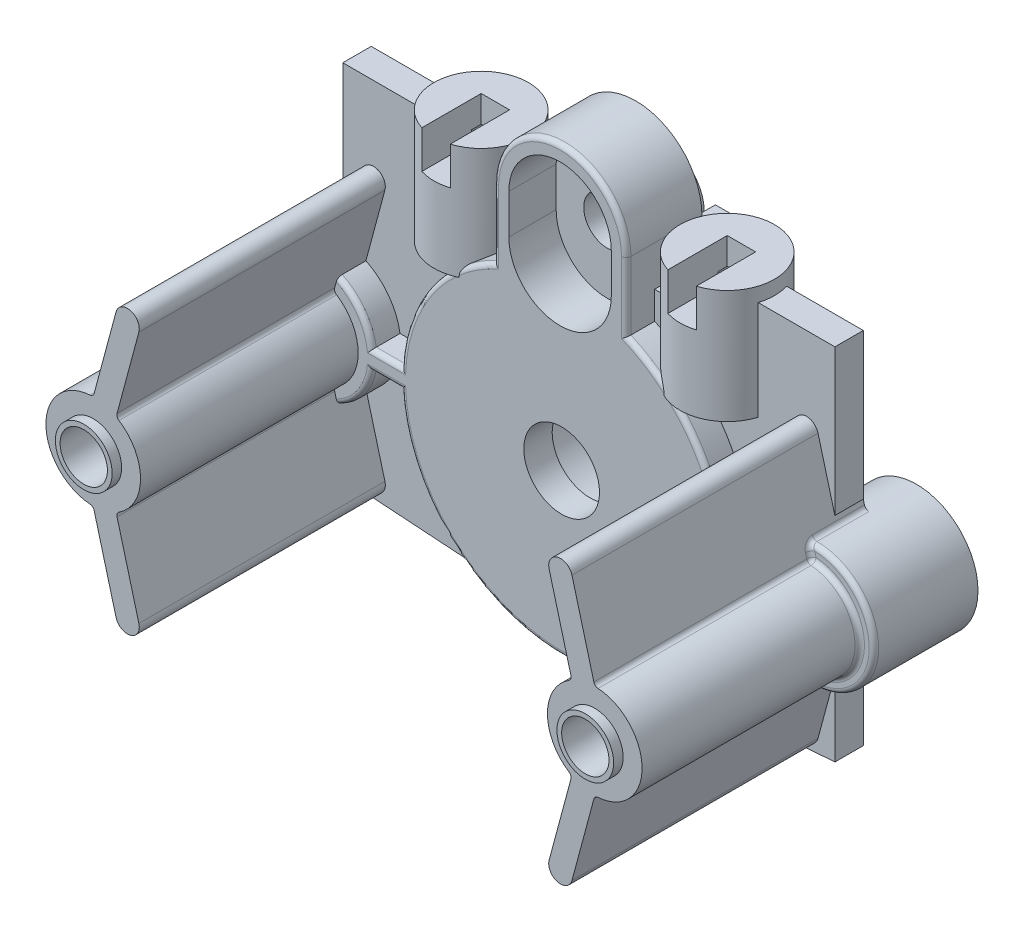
SolidWorks part; units mm, degrees
ref_plane "Plane1" through (0, 0, 0) normal (0, 0, 1) x (1, 0, 0)
ref_plane "Plane2" through (0, 0, 0) normal (0, 1, 0) x (1, 0, 0)
ref_plane "Plane3" through (0, 0, 0) normal (1, 0, 0) x (0, 0, -1)
sketch "Esquisse6" plane through (0, 0, 0) normal (0, 0, 1) x (1, 0, 0)
  line L0 (0, 0) -> (52, 0)
  line L1 (0, 0) -> (0, 38)
  line L2 (52, 38) -> (0, 38)
  line L3 (52, 38) -> (52, 0)
  dimension "D1" = 38
  dimension "D2" = 52
extrude "Base-Extrusion" add sketch "Esquisse6" along normal blind 3
sketch "Esquisse7" plane through (63.6237, 67.2393, 3) normal (0, 0, 1) x (1, 0, 0)
  line L2 (-11, -52) -> (-34, -52) construction
  line L3 (-11, -57) -> (-13.4089, -65.973)
  line L4 (-13.4207, -56.3749) -> (-15.8234, -65.3248)
  line L5 (-11, -47) -> (-13.4089, -38.027)
  line L6 (-13.4207, -47.6251) -> (-15.8234, -38.6752)
  line L7 (-37.5, -73) -> (-37.5, -13) construction
  line L9 (-64, -47) -> (-61.5911, -38.027)
  line L10 (-61.5793, -47.6251) -> (-59.1766, -38.6752)
  line L11 (-61.5793, -56.3749) -> (-59.1766, -65.3248)
  line L12 (-64, -57) -> (-61.5911, -65.973)
  arc A0 (-13.4207, -47.6251) -> (-13.4207, -56.3749) centre (-11, -52) ccw
  arc A1 (-13.4089, -38.027) -> (-15.8234, -38.6752) centre (-14.6162, -38.3511) ccw
  arc A2 (-13.4089, -65.973) -> (-15.8234, -65.3248) centre (-14.6162, -65.6489) cw
  arc A3 (-11, -57) -> (-11, -47) centre (-11, -52) ccw
  arc A4 (-64, -57) -> (-64, -47) centre (-64, -52) cw
  arc A5 (-61.5793, -47.6251) -> (-61.5793, -56.3749) centre (-64, -52) cw
  arc A6 (-61.5911, -38.027) -> (-59.1766, -38.6752) centre (-60.3838, -38.3511) cw
  arc A7 (-61.5911, -65.973) -> (-59.1766, -65.3248) centre (-60.3838, -65.6489) ccw
  dimension "D1" = 10
  dimension "D6" = 2.5
  dimension "D4" = 2.5
  dimension "D5" = 1.25
extrude "Boss.-Extru.3" add sketch "Esquisse7" along normal blind 29
sketch "Esquisse8" plane through (0, 0, 3) normal (0, 0, 1) x (1, 0, 0)
  line L0 (0, 38) -> (52, 38)
  line L1 (0, 38) -> (0, 0)
  line L2 (52, 0) -> (0, 0)
  line L3 (52, 0) -> (52, 38)
extrude "Boss.-Extru.4" add sketch "Esquisse8" along normal blind 3
sketch "Esquisse9" plane through (0, 0, 0) normal (0, 0, -1) x (-1, 0, 0)
  line L0 (-52, 38) -> (0, 38)
  line L1 (-52, 38) -> (-52, 0)
  line L2 (0, 0) -> (-52, 0)
  line L3 (0, 0) -> (0, 38)
extrude "Enlèv. mat.-Extru.5" cut sketch "Esquisse9" against normal blind 3
sketch "Esquisse10" plane through (0, 0, 32) normal (0, 0, 1) x (1, 0, 0)
  circle A0 centre (-0.3763, 15.2393) radius 2.5
  circle A1 centre (52.6237, 15.2393) radius 2.5
  dimension "D1" = 5
  dimension "D2" = 5
extrude "Enlèv. mat.-Extru.6" cut sketch "Esquisse10" against normal blind 43
sketch "Esquisse11" plane through (0, 0, 32) normal (0, 0, 1) x (1, 0, 0)
  circle A0 centre (-0.3763, 15.2393) radius 3
  circle A1 centre (52.6237, 15.2393) radius 3
  circle A2 centre (-0.3763, 15.2393) radius 2.5
  circle A3 centre (52.6237, 15.2393) radius 2.5
  dimension "D1" = 6
  dimension "D2" = 6
  dimension "D3" = 5
  dimension "D4" = 5
extrude "Boss.-Extru.5" add sketch "Esquisse11" along normal blind 1
sketch "Esquisse12" plane through (0, 0, 3) normal (0, 0, -1) x (-1, 0, 0)
  circle A0 centre (-52.6237, 15.2393) radius 6.5
  circle A1 centre (0.3763, 15.2393) radius 6.5
  dimension "D1" = 13
  dimension "D2" = 13
extrude "Boss.-Extru.6" add sketch "Esquisse12" against normal blind 6
sketch "Esquisse13" plane through (0, 0, 3) normal (0, 0, -1) x (-1, 0, 0)
  circle A0 centre (-52.6237, 15.2393) radius 6.5
  circle A1 centre (0.3763, 15.2393) radius 6.5
  dimension "D1" = 13
  dimension "D2" = 13
extrude "Boss.-Extru.7" add sketch "Esquisse13" along normal blind 5
sketch "Esquisse14" plane through (0, 0, -2) normal (0, 0, -1) x (-1, 0, 0)
  circle A0 centre (-52.6237, 15.2393) radius 4.5
  circle A1 centre (0.3763, 15.2393) radius 4.5
  dimension "D1" = 9
  dimension "D2" = 9
extrude "Enlèv. mat.-Extru.7" cut sketch "Esquisse14" against normal blind 6
sketch "Esquisse15" plane through (0, 0, 4) normal (0, 0, -1) x (-1, 0, 0)
  circle A0 centre (-52.6237, 15.2393) radius 2.5
  circle A1 centre (0.3763, 15.2393) radius 2.5
  dimension "D1" = 5
  dimension "D2" = 5
extrude "Enlèv. mat.-Extru.8" cut sketch "Esquisse15" against normal blind 16
sketch "Esquisse16" plane through (0, 0, 3) normal (0, 0, -1) x (-1, 0, 0)
  line L0 (-52.6237, 15.2393) -> (0.3763, 15.2393) construction
  line L1 (-26.1237, 15.2393) -> (-26.1237, 41.9193) construction
  circle A0 centre (-26.1237, 15.2393) radius 17
  dimension "D1" = 34
extrude "Boss.-Extru.8" add sketch "Esquisse16" along normal blind 5
sketch "Esquisse17" plane through (0, 0, 6) normal (0, 0, 1) x (1, 0, 0)
  line L0 (0, 0) -> (26.1237, -1.7607)
  line L1 (26.1237, -1.7607) -> (52, 0)
  line L2 (52, 0) -> (0, 0)
  arc A0 (18.5895, 0) -> (33.6579, 0) centre (26.1237, 15.2393) ccw construction
extrude "Boss.-Extru.10" add sketch "Esquisse17" against normal blind 3
sketch "Esquisse20" plane through (0, 0, -2) normal (0, 0, -1) x (-1, 0, 0)
  line L0 (-52.6237, 15.2393) -> (-38.9139, 15.2393) construction
  line L1 (-42.2354, 16.2429) -> (-48.2354, 16.2429)
  line L2 (-42.2354, 16.2429) -> (-42.2354, 14.2429)
  line L3 (-48.2354, 14.2429) -> (-42.2354, 14.2429)
  line L4 (-48.2354, 14.2429) -> (-48.2354, 16.2429)
  line L5 (-26.1237, 15.2393) -> (-26.1237, 27.3291) construction
  line L6 (-10.012, 16.2429) -> (-4.012, 16.2429)
  line L7 (-4.012, 14.2429) -> (-10.012, 14.2429)
  line L8 (-4.012, 14.2429) -> (-4.012, 16.2429)
  line L9 (-10.012, 16.2429) -> (-10.012, 14.2429)
  circle A0 centre (-52.6237, 15.2393) radius 4.5 construction
  dimension "D1" = 2
  dimension "D2" = 6
extrude "Boss.-Extru.12" add sketch "Esquisse20" against normal blind 5
sketch "Esquisse21" plane through (0, 0, 6) normal (0, 0, 1) x (1, 0, 0)
  circle A0 centre (26.1237, 15.2393) radius 17
extrude "Boss.-Extru.13" add sketch "Esquisse21" along normal blind 3
sketch "Esquisse22" plane through (0, 0, 9) normal (0, 0, 1) x (1, 0, 0)
  line L0 (10.1518, 16.2429) -> (3.2399, 16.2429)
  line L1 (10.1518, 16.2429) -> (10.1518, 14.2429)
  line L2 (3.2399, 14.2429) -> (10.1518, 14.2429)
  line L3 (3.2399, 14.2429) -> (3.2399, 16.2429)
  line L4 (26.1237, 15.2393) -> (26.1237, 28.5641) construction
  line L5 (42.0956, 16.2429) -> (49.0075, 16.2429)
  line L6 (49.0075, 14.2429) -> (42.0956, 14.2429)
  line L7 (49.0075, 14.2429) -> (49.0075, 16.2429)
  line L8 (42.0956, 16.2429) -> (42.0956, 14.2429)
  dimension "D1" = 2
extrude "Boss.-Extru.14" add sketch "Esquisse22" against normal blind 4
ref_plane "Plan4" through (0, 39.5, 0) normal (0, 1, 0) x (-1, 0, 0)
sketch "Esquisse23" plane through (0, 39.5, 0) normal (0, 1, 0) x (-1, 0, 0)
  line L0 (-52, 3) -> (0, 3) construction
  line L1 (-26.1237, -1.6867) -> (-26.1237, 32.8088) construction
  line L2 (-26.1237, 59) -> (-26.1237, -41) construction
  circle A0 centre (-39.1237, 4.5) radius 5
  circle A1 centre (-13.1237, 4.5) radius 5
  dimension "D1" = 10
  dimension "D2" = 1.5
  dimension "D3" = 13
extrude "Boss.-Extru.16" add sketch "Esquisse23" against normal blind 12
sketch "Esquisse24" plane through (0, 39.5, 0) normal (0, 1, 0) x (-1, 0, 0)
  line L0 (-14.6237, 12.0698) -> (-11.6237, 12.0698)
  line L1 (-14.6237, 12.0698) -> (-14.6237, 3)
  line L2 (-11.6237, 3) -> (-14.6237, 3)
  line L3 (-11.6237, 3) -> (-11.6237, 12.0698)
  line L4 (-26.1237, 10.3304) -> (-26.1237, -5.7477) construction
  line L5 (-26.1237, 59) -> (-26.1237, -41) construction
  line L6 (-37.6237, 12.0698) -> (-37.6237, 3)
  line L7 (-40.6237, 3) -> (-37.6237, 3)
  line L8 (-37.6237, 12.0698) -> (-40.6237, 12.0698)
  line L9 (-40.6237, 3) -> (-40.6237, 12.0698)
  dimension "D1" = 3
  dimension "D2" = 1.5
extrude "Enlèv. mat.-Extru.9" cut sketch "Esquisse24" against normal blind 4
sketch "Esquisse25" plane through (0, 35.5, 0) normal (0, 1, 0) x (-1, 0, 0)
  line L0 (-26.1237, 9) -> (-26.1237, -4.1362) construction
  line L3 (-26.1237, 59) -> (-26.1237, -41) construction
  circle A0 centre (-39.1237, 4.5) radius 1.5
  circle A1 centre (-13.1237, 4.5) radius 1.5
extrude "Enlèv. mat.-Extru.10" cut sketch "Esquisse25" against normal blind 3
sketch "Esquisse28" plane through (0, 0, -2) normal (0, 0, -1) x (-1, 0, 0)
  line L0 (-15.1237, 36.6832) -> (-11.1237, 36.6832)
  line L1 (-15.1237, 36.6832) -> (-15.1237, 34.6832)
  line L2 (-11.6237, 34.6832) -> (-12.1237, 34.6832)
  line L3 (-13.1237, -22.5) -> (-13.1237, 77.5) construction
  line L4 (-11.6237, 32.5) -> (-11.6237, 35.5) construction
  line L5 (-11.1237, 36.6832) -> (-11.1237, 34.6832)
  line L6 (-11.6237, 34.6832) -> (-11.1237, 34.6832)
  line L7 (-26.1237, 46.5574) -> (-26.1237, 23.3105) construction
  line L8 (-40.6237, 34.6832) -> (-40.1237, 34.6832)
  line L9 (-37.1237, 36.6832) -> (-41.1237, 36.6832)
  line L10 (-37.1237, 36.6832) -> (-37.1237, 34.6832)
  line L11 (-40.6237, 34.6832) -> (-41.1237, 34.6832)
  line L12 (-41.1237, 36.6832) -> (-41.1237, 34.6832)
  line L13 (-14.1237, 30) -> (-14.1237, 29)
  line L14 (-14.1237, 29) -> (-12.1237, 29)
  line L15 (-12.1237, 29) -> (-12.1237, 34.6832)
  line L16 (-13.1237, -17.5) -> (-13.1237, 82.5) construction
  line L17 (-8.354, 27.5) -> (-14.3477, 27.5) construction
  line L18 (-14.1237, 34.6832) -> (-14.1237, 30)
  line L19 (-14.1237, 34.6832) -> (-15.1237, 34.6832)
  line L20 (-40.1237, 29) -> (-40.1237, 34.6832)
  line L21 (-38.1237, 34.6832) -> (-38.1237, 30)
  line L22 (-38.1237, 29) -> (-40.1237, 29)
  line L23 (-38.1237, 30) -> (-38.1237, 29)
  line L24 (-38.1237, 34.6832) -> (-37.1237, 34.6832)
  dimension "D1" = 2
  dimension "D2" = 2
  dimension "D3" = 1
  dimension "D4" = 2
  dimension "D5" = 1.5
  dimension "D6" = 2
extrude "Enlèv. mat.-Extru.11" cut sketch "Esquisse28" against normal blind 6
sketch "Esquisse29" plane through (0, 38, 0) normal (0, 1, 0) x (-1, 0, 0)
  line L0 (-32.9505, 9) -> (-18.9651, 9)
  line L1 (-32.9505, 9) -> (-32.9505, -2)
  line L2 (-18.9651, -2) -> (-32.9505, -2)
  line L3 (-18.9651, -2) -> (-18.9651, 9)
  line L4 (-36.9443, 9) -> (-15.3032, 9) construction
  line L5 (-9.1534, -2) -> (-43.0941, -2) construction
extrude "Boss.-Extru.17" add sketch "Esquisse29" against normal blind 10
sketch "Esquisse30" plane through (0, 0, -2) normal (0, 0, -1) x (-1, 0, 0)
  line L0 (-18.9651, 38) -> (-32.9505, 38) construction
  circle A0 centre (-25.9578, 38) radius 6.9927
extrude "Boss.-Extru.18" add sketch "Esquisse30" against normal blind 11
sketch "Esquisse31" plane through (0, 0, -2) normal (0, 0, -1) x (-1, 0, 0)
  line L0 (-33.6399, 36.6832) -> (-18.6399, 36.6832)
  line L1 (-33.6399, 36.6832) -> (-33.6399, 47.4549)
  line L2 (-18.6399, 47.4549) -> (-33.6399, 47.4549)
  line L3 (-18.6399, 47.4549) -> (-18.6399, 36.6832)
  dimension "D1" = 15
extrude "Enlèv. mat.-Extru.13" cut sketch "Esquisse31" against normal blind 3
sketch "Esquisse32" plane through (0, 0, -2) normal (0, 0, -1) x (-1, 0, 0)
  line L0 (-31.3704, 38) -> (-31.3704, 33.8239)
  line L1 (-20.5452, 38) -> (-20.5452, 33.8239)
  arc A0 (-20.5452, 38) -> (-31.3704, 38) centre (-25.9578, 38) ccw
  arc A2 (-31.3704, 33.8239) -> (-20.5452, 33.8239) centre (-25.9578, 33.8239) ccw
extrude "Enlèv. mat.-Extru.14" cut sketch "Esquisse32" against normal blind 5
sketch "Esquisse33" plane through (0, 0, -2) normal (0, 0, -1) x (-1, 0, 0)
  line L0 (-28.7912, 29.2123) -> (-28.7912, 28.3509)
  line L1 (-28.7912, 28.3509) -> (-23.1244, 28.3509)
  line L2 (-23.1244, 28.3509) -> (-23.1244, 29.2123)
  line L3 (-28.7912, 29.2123) -> (-23.1244, 29.2123)
  line L4 (-25.9578, 33.8239) -> (-25.9578, 23.6111) construction
  arc A0 (-31.3704, 33.8239) -> (-20.5452, 33.8239) centre (-25.9578, 33.8239) ccw construction
  dimension "D1" = 5.6669
extrude "Enlèv. mat.-Extru.15" cut sketch "Esquisse33" against normal blind 3
sketch "Esquisse37" plane through (0, 0, 3) normal (0, 0, -1) x (-1, 0, 0)
  circle A0 centre (-25.9578, 35.5) radius 4.2336
extrude "Boss.-Extru.19" add sketch "Esquisse37" along normal blind 5
sketch "Esquisse38" plane through (0, 0, 3) normal (0, 0, -1) x (-1, 0, 0)
  line L0 (-34.354, 38) -> (-32.9505, 38)
  line L1 (-34.354, 38) -> (-34.354, 33.7458)
  line L2 (-32.9505, 33.7458) -> (-34.354, 33.7458)
  line L3 (-32.9505, 33.7458) -> (-32.9505, 38)
  line L4 (-32.9505, 30.8083) -> (-32.9505, 36.6832) construction
extrude "Enlèv. mat.-Extru.16" cut sketch "Esquisse38" against normal blind 5
sketch "Esquisse39" plane through (0, 0, 3) normal (0, 0, -1) x (-1, 0, 0)
  line L0 (-18.9651, 38) -> (-17.8934, 38)
  line L1 (-18.9651, 38) -> (-18.9651, 33.8239)
  line L2 (-17.8934, 33.8239) -> (-18.9651, 33.8239)
  line L3 (-17.8934, 33.8239) -> (-17.8934, 38)
extrude "Enlèv. mat.-Extru.17" cut sketch "Esquisse39" against normal blind 5
sketch "Esquisse40" plane through (0, 0, 9) normal (0, 0, 1) x (1, 0, 0)
  line L0 (20.5452, 38) -> (20.5452, 33.8239)
  line L1 (31.3704, 38) -> (31.3704, 33.8239)
  arc A0 (31.3704, 38) -> (20.5452, 38) centre (25.9578, 38) ccw
  arc A1 (20.5452, 33.8239) -> (31.3704, 33.8239) centre (25.9578, 33.8239) ccw
extrude "Enlèv. mat.-Extru.18" cut sketch "Esquisse40" against normal blind 5
sketch "Esquisse41" plane through (0, 0, 4) normal (0, 0, 1) x (1, 0, 0)
  circle A0 centre (25.9578, 35.5) radius 2.5
  dimension "D1" = 5
extrude "Enlèv. mat.-Extru.19" cut sketch "Esquisse41" against normal blind 4
fillet "Congé2" radius 0.5
fillet "Congé3" radius 0.5
fillet "Congé4" radius 0.5
fillet "Congé5" radius 0.5
fillet "Congé6" radius 0.5
fillet "Congé7" radius 0.5
fillet "Congé8" radius 0.5
fillet "Congé11" radius 0.5
sketch "Esquisse42" plane through (0, 0, 9) normal (0, 0, 1) x (1, 0, 0)
  circle A0 centre (26.1237, 15.2393) radius 4
  dimension "D1" = 8
extrude "Enlèv. mat.-Extru.20" cut sketch "Esquisse42" against normal blind 18
sketch "Esquisse43" plane through (0, 0, -2) normal (0, 0, -1) x (-1, 0, 0)
  circle A0 centre (-26.1237, 15.2393) radius 6
  dimension "D1" = 12
extrude "Enlèv. mat.-Extru.21" cut sketch "Esquisse43" against normal blind 8
